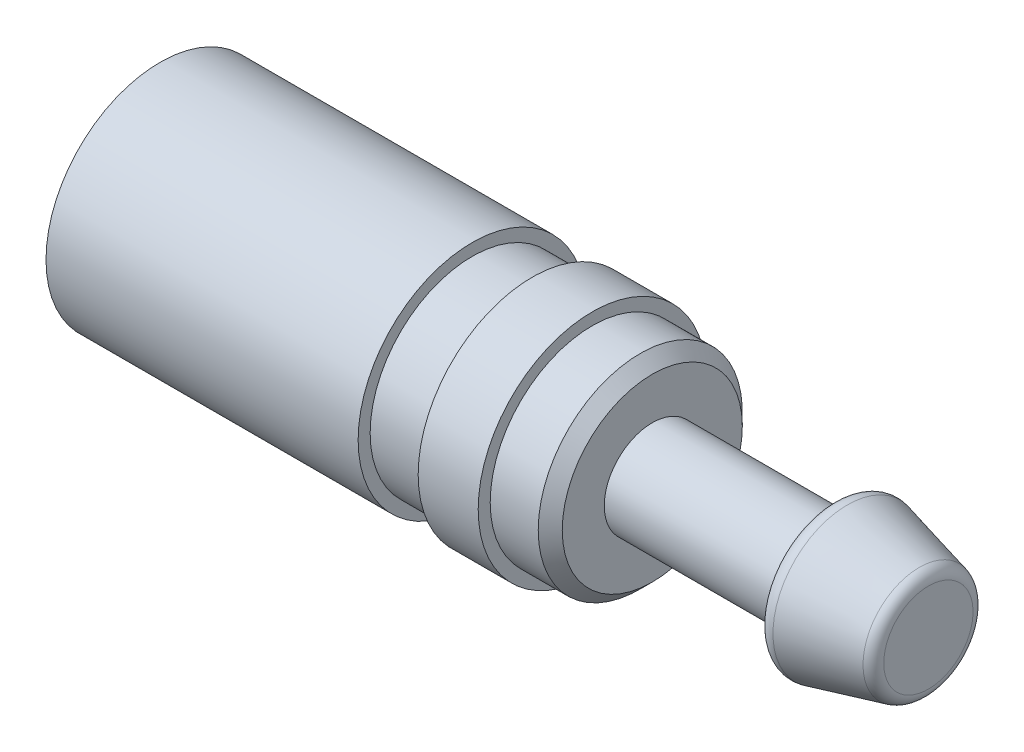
SolidWorks part; units mm, degrees
ref_plane "Alzado" through (0, 0, 0) normal (0, 0, 1) x (1, 0, 0)
ref_plane "Planta" through (0, 0, 0) normal (0, 1, 0) x (1, 0, 0)
ref_plane "Vista lateral" through (0, 0, 0) normal (1, 0, 0) x (0, 0, -1)
sketch "Croquis1" plane through (0, 0, 0) normal (0, 0, 1) x (1, 0, 0)
  line L0 (0, 0) -> (36.1529, 0) construction
  line L1 (0, 0) -> (0, 9.5)
  line L2 (0, 9.5) -> (26, 9.5)
  line L3 (26, 9.5) -> (26, 8.5)
  line L4 (26, 8.5) -> (31, 8.5)
  line L5 (31, 8.5) -> (31, 9.5)
  line L6 (31, 9.5) -> (36, 9.5)
  line L7 (36, 9.5) -> (36, 8.5)
  line L8 (36, 8.5) -> (41, 8.5)
  line L9 (41, 8.5) -> (41, 4)
  line L10 (41, 4) -> (56, 4)
  line L11 (56, 4) -> (56, 6.5)
  line L12 (56, 6.5) -> (64, 4.5)
  line L15 (0, 0) -> (64, 0)
  line L16 (64, 0) -> (64, 4.5)
  dimension "D1" = 19
  dimension "D2" = 26
  dimension "D3" = 1
  dimension "D4" = 5
  dimension "D5" = 5
  dimension "D6" = 5
  dimension "D7" = 8
  dimension "D8" = 15
  dimension "D9" = 9
  dimension "D10" = 23
  dimension "D11" = 13
revolve "Revolución1" add sketch "Croquis1" angle 360 about L0
fillet "Redondeo1" radius 1 2 edges at (64, 0, 4.5) (56, 0, 6.5)
chamfer "Chaflán1" distance 1 angle 45 1 edges at (41, 0, 8.5)
